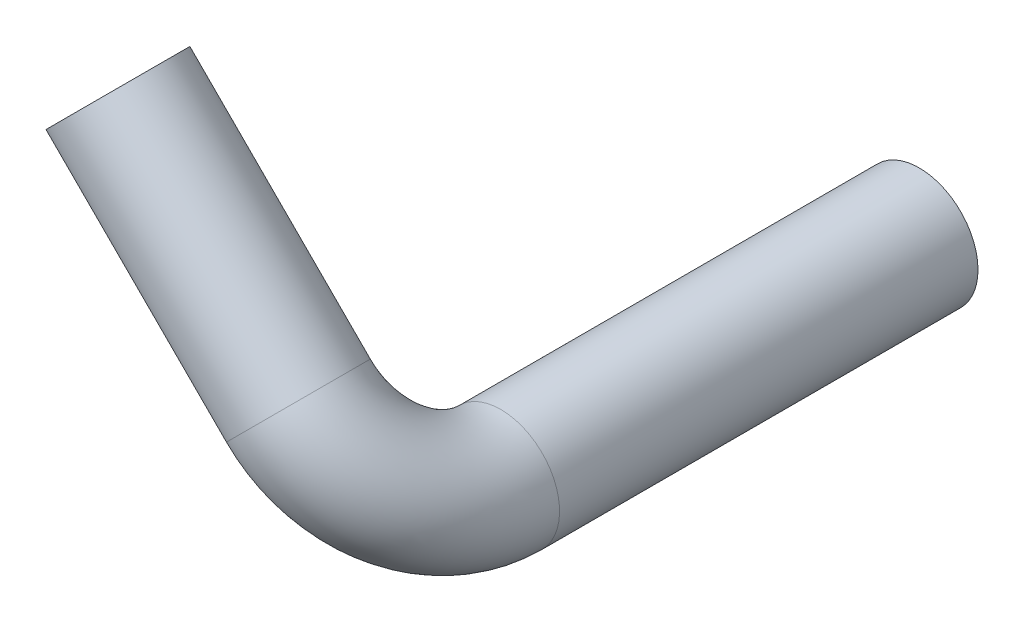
SolidWorks part; units mm, degrees
ref_plane "Front" through (0, 0, 0) normal (0, 0, 1) x (1, 0, 0)
ref_plane "Top" through (0, 0, 0) normal (0, 1, 0) x (1, 0, 0)
ref_plane "Side" through (0, 0, 0) normal (1, 0, 0) x (0, 0, -1)
sketch "PipeSketch"
  dimension "OuterDiameter" = 60.452
  dimension "InnerDiameter" = 52.6288
extrude "Extrusion" add sketch "PipeSketch" along normal blind 215.2153
sketch "FilterSketch" plane through (0, 0, 0) normal (0, 0, 1) x (1, 0, 0)
  circle A0 centre (0, 0) radius 25.4 construction
  dimension "NominalDiameter" = 50.8
sketch "Sketch1" plane through (0, 0, 215.2153) normal (0, 0, 1) x (1, 0, 0)
  line L0 (-43.1052, 43.1052) -> (-86.2105, 0) construction
  circle A0 centre (0, 0) radius 30.226 construction
  circle A1 centre (0, 0) radius 26.3144 construction
  circle A2 centre (0, 0) radius 30.226
  circle A3 centre (0, 0) radius 26.3144
revolve "Revolve1" add sketch "Sketch1" angle 90 about L0
sketch "Sketch2" plane through (-43.1052, 43.1052, 0) normal (-0.7071, 0.7071, 0) x (-0.7071, -0.7071, 0)
  circle A0 centre (0, 276.1753) radius 26.3144 construction
  circle A1 centre (0, 276.1753) radius 30.226 construction
  circle A2 centre (0, 276.1753) radius 26.3144
  circle A3 centre (0, 276.1753) radius 30.226
extrude "Extrude1" add sketch "Sketch2" along normal blind 131.2756
